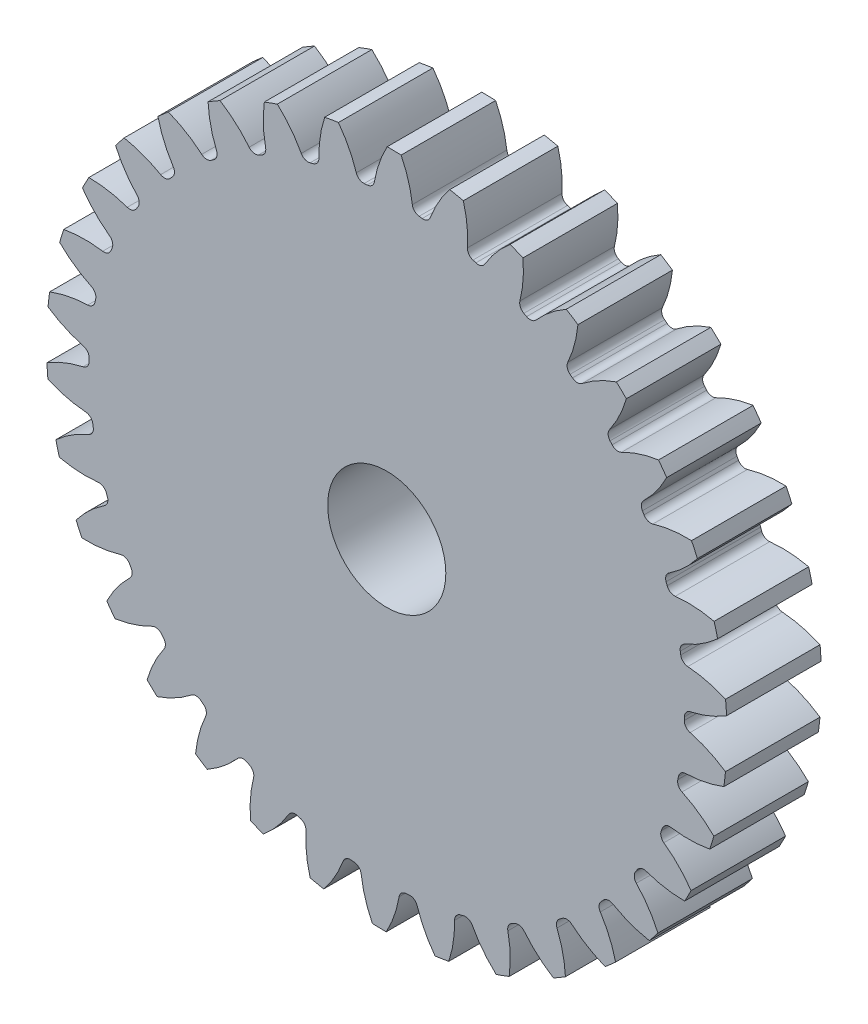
SolidWorks part; units mm, degrees
ref_plane "Front" through (0, 0, 0) normal (0, 0, 1) x (1, 0, 0)
ref_plane "Top" through (0, 0, 0) normal (0, 1, 0) x (1, 0, 0)
ref_plane "Right" through (0, 0, 0) normal (1, 0, 0) x (0, 0, -1)
sketch "Sketch3" plane through (0, 0, 0) normal (0, 0, 1) x (1, 0, 0)
  circle A0 centre (0, 0) radius 365.76
  dimension "od" = 731.52
extrude "gearBody" add sketch "Sketch3" along normal blind 101.6
sketch "Sketch2" plane through (0, 0, 0) normal (0, 0, 1) x (1, 0, 0)
  line L0 (0, 0) -> (299.8982, 124.2219) construction
  line L1 (364.5971, -34.5807) -> (0, 0) construction
  line L2 (0, 0) -> (36.3143, 0) construction
  line L3 (345.339, 8.3519) -> (344.6441, -23.4356) construction
  line L5 (344.9916, -7.5419) -> (0, 0) construction
  line L7 (0, 0) -> (324.6074, 0) construction
  arc A0 (324.5997, 2.2359) -> (324.1919, -16.4192) centre (0, 0) ccw construction
  arc A1 (365.3005, 18.3291) -> (364.1505, -34.2757) centre (0, 0) ccw construction
  arc A2 (345.339, 8.3519) -> (344.6441, -23.4356) centre (0, 0) ccw construction
  arc A3 (319.9222, -8.6829) -> (319.996, -5.3064) centre (0, 0) ccw
  arc A4 (364.5971, -34.5807) -> (326.0705, -16.9015) centre (294.183, -137.2091) ccw
  arc A5 (364.5971, -34.5807) -> (365.76, 18.6143) centre (0, 0) ccw
  arc A6 (365.76, 18.6143) -> (326.4976, 2.6357) centre (299.8982, 124.2219) cw
  arc A7 (319.996, -5.3064) -> (326.4976, 2.6357) centre (328.2651, -5.4435) cw
  arc A8 (326.0705, -16.9015) -> (319.9222, -8.6829) centre (328.1894, -8.9073) cw
  point P6 (365.76, 18.6143)
  point P22 (364.5971, -34.5807)
  dimension "baseDia" = 649.2148
  dimension "od" = 731.52
  dimension "pd" = 690.88
  dimension "rd" = 640.08
  dimension "rFillet" = 8.2702
  dimension "pointX" = 365.76
  dimension "pointY" = 18.6143
  dimension "CTT" = 31.7875
  dimension "flankCenterAngle" = 22.5
extrude "toothCut" cut sketch "Sketch2" along normal through all
pattern_circular "CirPattern1" count 34 over 360 about axis through (0, 0, 0) along (0, 0, 1) of "toothCut"
sketch "hub1Dia" plane through (0, 0, 0) normal (0, 0, -1) x (-1, 0, 0)
  circle A0 centre (0, 0) radius 12.7
  dimension "hub1Dia" = 25.4
sketch "hub2Dia" plane through (0, 0, 101.6) normal (0, 0, 1) x (1, 0, 0)
  circle A0 centre (0, 0) radius 12.7
  dimension "hub2dia" = 25.4
sketch "boreDia" plane through (0, 0, 0) normal (0, 0, 1) x (1, 0, 0)
  circle A0 centre (0, 0) radius 63.5
  dimension "boreDia" = 127
extrude "bore" cut sketch "boreDia" against normal mid plane 25400
